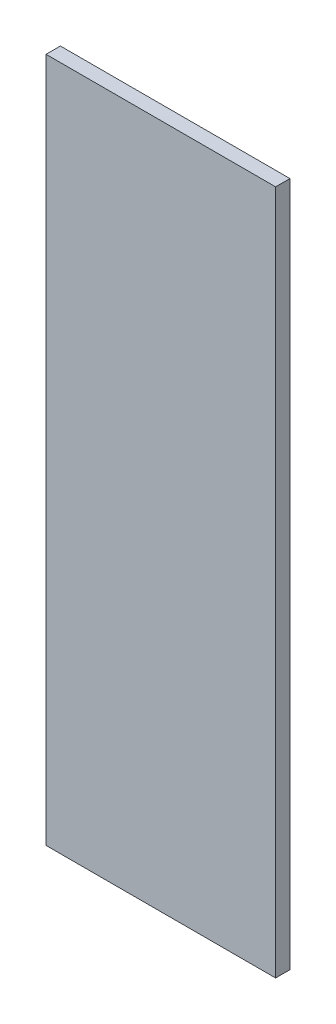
SolidWorks part; units mm, degrees
ref_plane "Front" through (0, 0, 0) normal (0, 0, 1) x (1, 0, 0)
ref_plane "Top" through (0, 0, 0) normal (0, 1, 0) x (1, 0, 0)
ref_plane "Right" through (0, 0, 0) normal (1, 0, 0) x (0, 0, -1)
sketch "Sketch1" plane through (0, 0, 0) normal (0, 0, 1) x (1, 0, 0)
  line L0 (-101.6, 303.2125) -> (101.6, -303.2125) construction
  line L1 (-101.6, 303.2125) -> (101.6, 303.2125)
  line L2 (-101.6, 303.2125) -> (-101.6, -303.2125)
  line L3 (-101.6, -303.2125) -> (101.6, -303.2125)
  line L4 (101.6, 303.2125) -> (101.6, -303.2125)
  point P4 (0, 0)
  dimension "D1" = 203.2
  dimension "D3" = 606.425
extrude "Extrude1" add sketch "Sketch1" along normal blind 12.7
